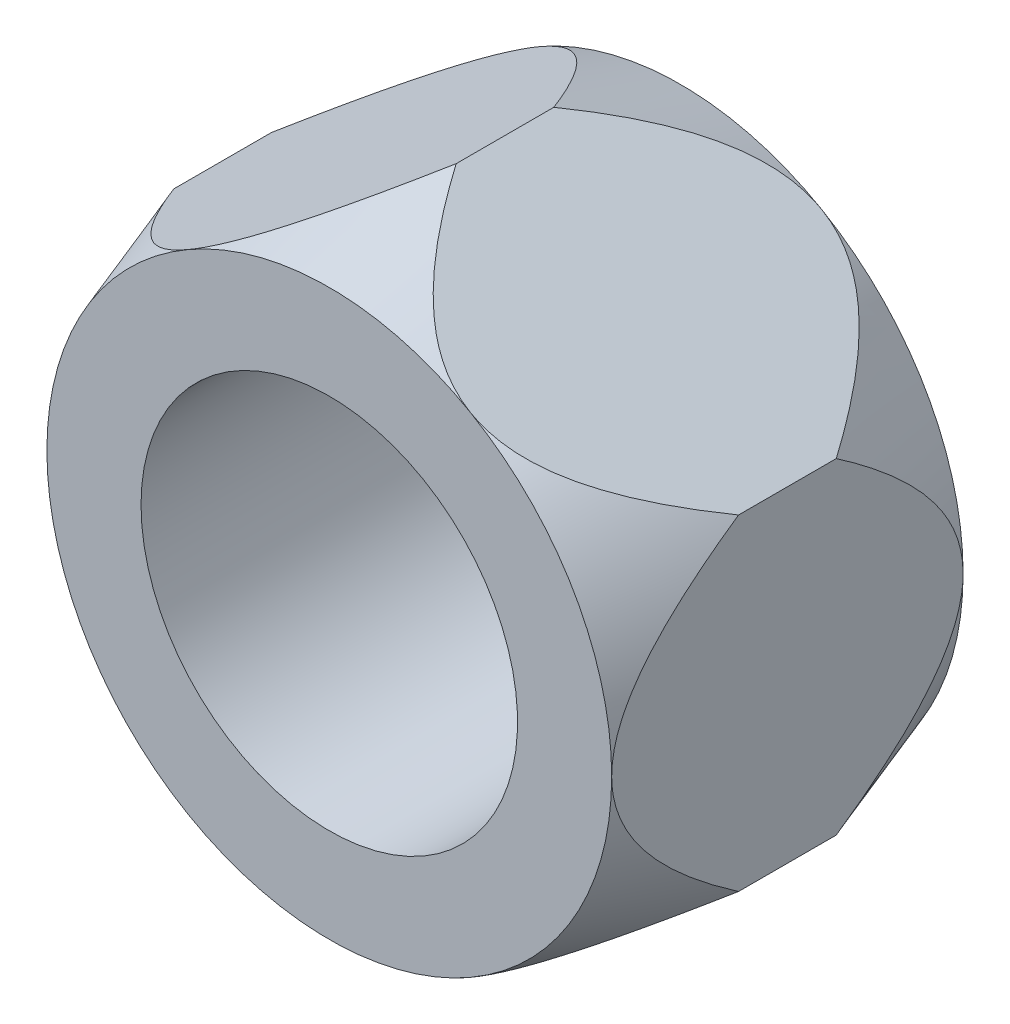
SolidWorks part; units mm, degrees
ref_plane "Front Plane" through (0, 0, 0) normal (0, 0, 1) x (1, 0, 0)
ref_plane "Top Plane" through (0, 0, 0) normal (0, 1, 0) x (1, 0, 0)
ref_plane "Right Plane" through (0, 0, 0) normal (1, 0, 0) x (0, 0, -1)
sketch "Sketch1" plane through (0, 0, 0) normal (0, 0, 1) x (1, 0, 0)
  line L1 (0, 2.5981) -> (-2.25, 1.299)
  line L2 (-2.25, 1.299) -> (-2.25, -1.299)
  line L3 (-2.25, -1.299) -> (0, -2.5981)
  line L4 (0, -2.5981) -> (2.25, -1.299)
  line L5 (2.25, -1.299) -> (2.25, 1.299)
  line L6 (2.25, 1.299) -> (0, 2.5981)
  circle A0 centre (0, 0) radius 2.25 construction
extrude "Boss-Extrude1" add sketch "Sketch1" along normal blind 2.8
sketch "Sketch2" plane through (0, 0, 2.8) normal (0, 0, 1) x (1, 0, 0)
  circle A0 centre (0, 0) radius 2.25
extrude "Cut-Extrude1" cut sketch "Sketch2" against normal blind 2.8 draft 19 flip side to cut
sketch "Sketch3" plane through (0, 0, 0) normal (0, 0, -1) x (-1, 0, 0)
  circle A0 centre (0, 0) radius 2.25
extrude "Cut-Extrude2" cut sketch "Sketch3" against normal blind 2.8 draft 19 flip side to cut
sketch "Sketch4" plane through (0, 0, 0) normal (0, 0, -1) x (-1, 0, 0)
  circle A0 centre (0, 0) radius 1.5
extrude "Cut-Extrude3" cut sketch "Sketch4" against normal blind 2.8
